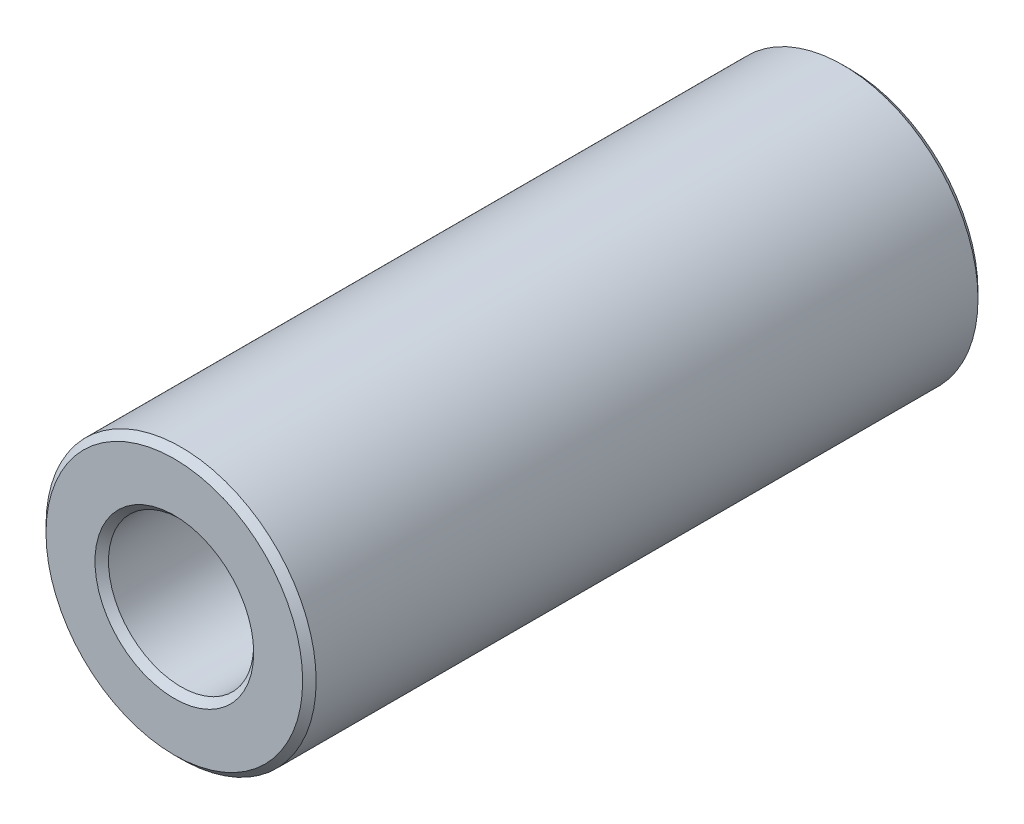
SolidWorks part; units mm, degrees
ref_plane "Front Plane" through (0, 0, 0) normal (0, 0, 1) x (1, 0, 0)
ref_plane "Top Plane" through (0, 0, 0) normal (0, 1, 0) x (1, 0, 0)
ref_plane "Right Plane" through (0, 0, 0) normal (1, 0, 0) x (0, 0, -1)
sketch "Sketch1" plane through (0, 0, 0) normal (0, 0, 1) x (1, 0, 0)
  circle A0 centre (0, 0) radius 4
  circle A1 centre (0, 0) radius 2.15
  dimension "D1" = 8
  dimension "D2" = 4.3
extrude "Boss-Extrude2" add sketch "Sketch1" along normal mid plane 20
chamfer "Chamfer3" distance 0.2 angle 45 4 edges at (4, 0, 10) (4, 0, -10) (2.15, 0, -10) (2.15, 0, 10)
